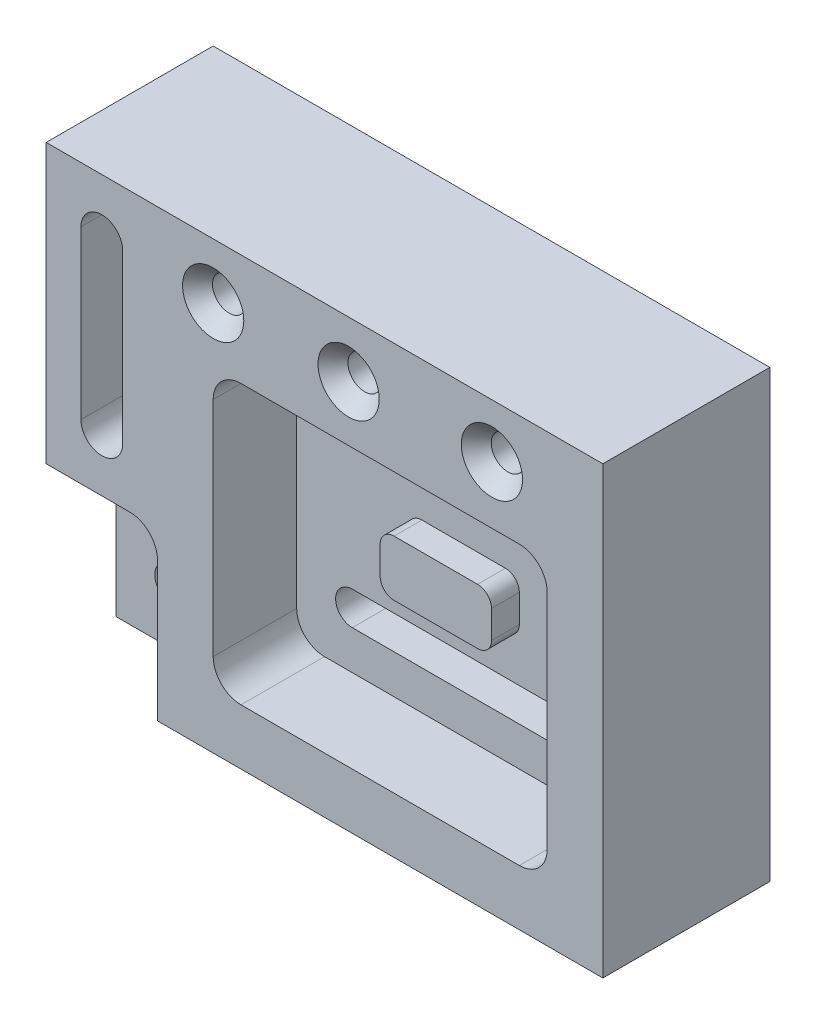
SolidWorks part; units mm, degrees
ref_plane "Plane1" through (0, 0, 0) normal (0, 0, 1) x (1, 0, 0)
ref_plane "Plane2" through (0, 0, 0) normal (0, 1, 0) x (1, 0, 0)
ref_plane "Plane3" through (0, 0, 0) normal (1, 0, 0) x (0, 0, -1)
sketch "Sketch1" plane through (0, 0, 0) normal (0, 0, 1) x (1, 0, 0)
  line L0 (-100, 80) -> (100, 80)
  line L1 (-100, 80) -> (-100, -80)
  line L2 (100, -80) -> (-100, -80)
  line L3 (100, -80) -> (100, 80)
extrude "Base-Extrude" add sketch "Sketch1" against normal blind 60
sketch "Sketch2" plane through (0, 0, 0) normal (0, 0, 1) x (1, 0, 0)
  line L0 (-30, 40) -> (70, 40)
  line L1 (-40, 30) -> (-40, -50)
  line L2 (70, -60) -> (-30, -60)
  line L3 (80, -50) -> (80, 30)
  arc A0 (80, 30) -> (70, 40) centre (70, 30) ccw
  arc A1 (80, -50) -> (70, -60) centre (70, -50) cw
  arc A2 (-30, -60) -> (-40, -50) centre (-30, -50) cw
  arc A3 (-40, 30) -> (-30, 40) centre (-30, 30) cw
  dimension "D1" = 10
extrude "Cut-Extrude1" cut sketch "Sketch2" against normal blind 30
sketch "Sketch3" plane through (0, 0, 0) normal (0, 0, 1) x (1, 0, 0)
  line L0 (-120, -20) -> (-70, -20)
  line L1 (-120, -20) -> (-120, -100)
  line L2 (-60, -100) -> (-120, -100)
  line L3 (-60, -100) -> (-60, -30)
  arc A0 (-60, -30) -> (-70, -20) centre (-70, -30) ccw
  dimension "D1" = 10
extrude "Cut-Extrude2" cut sketch "Sketch3" against normal blind 25
hole_wizard "Hole1" positions "Sketch8" profile "Sketch7" legacy
sketch "Sketch8" plane through (0, 0, 0) normal (0, 0, 1) x (1, 0, 0)
  point P0 (-40, 60)
sketch "Sketch7" plane through (-40, 60, 0) normal (1, 0, 0) x (0, -1, 0)
  line L0 (0, 0) -> (0, 60)
  line L1 (0, 60) -> (6, 60)
  line L2 (6, 60) -> (6, 5.7518)
  line L3 (6, 5.7518) -> (11, 0)
  line L4 (11, 0) -> (0, 0)
  line L5 (0, -6.4453) -> (0, 115.525) construction
  line L6 (-6, 5.7518) -> (-11, 0) construction
  dimension "Diameter" = 12
  dimension "Depth" = 60
  dimension "C-Sink Angle" = 82
  dimension "C-Sink Diameter" = 22
hole_wizard "Hole4" positions "Sketch17" profile "Sketch18" legacy
sketch "Sketch17" plane through (41.9973, -0.1277, 0) normal (0, 0, 1) x (1, 0, 0)
  point P0 (-33.3333, 60)
sketch "Sketch18" plane through (8.6639, 59.8723, 0) normal (1, 0, 0) x (0, -1, 0)
  line L0 (0, 0) -> (0, 60)
  line L1 (0, 60) -> (6, 60)
  line L2 (6, 60) -> (6, 5.7518)
  line L3 (6, 5.7518) -> (11, 0)
  line L4 (11, 0) -> (0, 0)
  line L5 (0, -6.4453) -> (0, 115.525) construction
  line L6 (-6, 5.7518) -> (-11, 0) construction
  dimension "Diameter" = 12
  dimension "Depth" = 60
  dimension "C-Sink Angle" = 82
  dimension "C-Sink Diameter" = 22
hole_wizard "Hole5" positions "Sketch19" profile "Sketch20" legacy
sketch "Sketch19" plane through (100.1484, 0.6571, 0) normal (0, 0, 1) x (1, 0, 0)
  point P0 (-40, 60)
sketch "Sketch20" plane through (60.1484, 60.6571, 0) normal (1, 0, 0) x (0, -1, 0)
  line L0 (0, 0) -> (0, 60)
  line L1 (0, 60) -> (6, 60)
  line L2 (6, 60) -> (6, 5.7518)
  line L3 (6, 5.7518) -> (11, 0)
  line L4 (11, 0) -> (0, 0)
  line L5 (0, -6.4453) -> (0, 115.525) construction
  line L6 (-6, 5.7518) -> (-11, 0) construction
  dimension "Diameter" = 12
  dimension "Depth" = 60
  dimension "C-Sink Angle" = 82
  dimension "C-Sink Diameter" = 22
sketch "Sketch21" plane through (0, 0, -25) normal (0, 0, 1) x (1, 0, 0)
  circle A0 centre (-80, -33.3333) radius 6
  circle A1 centre (-80, -60) radius 6
  dimension "D1" = 12
  dimension "D2" = 12
extrude "Cut-Extrude4" cut sketch "Sketch21" against normal through all
sketch "Sketch22" plane through (0, 0, 0) normal (0, 0, 1) x (1, 0, 0)
  line L0 (-72.5, 60) -> (-72.5, 0)
  line L1 (-87.5, 60) -> (-87.5, 0)
  arc A0 (-87.5, 0) -> (-72.5, 0) centre (-80, 0) ccw
  arc A1 (-72.5, 60) -> (-87.5, 60) centre (-80, 60) ccw
  dimension "D1" = 15
  dimension "D2" = 15
extrude "Cut-Extrude5" cut sketch "Sketch22" against normal blind 25
sketch "Sketch23" plane through (0, 0, -30) normal (0, 0, 1) x (1, 0, 0)
  line L0 (-20, 26) -> (60.1484, 26)
  line L1 (-20, 14) -> (60.1484, 14)
  line L2 (-20, -34) -> (60.1484, -34)
  line L3 (-20, -46) -> (60.1484, -46)
  arc A0 (-20, 26) -> (-20, 14) centre (-20, 20) ccw
  arc A1 (60.1484, 14) -> (60.1484, 26) centre (60.1484, 20) ccw
  arc A2 (-20, -34) -> (-20, -46) centre (-20, -40) ccw
  arc A3 (60.1484, -46) -> (60.1484, -34) centre (60.1484, -40) ccw
  dimension "D1" = 12
  dimension "D2" = 12
  dimension "D3" = 12
  dimension "D4" = 12
extrude "Cut-Extrude6" cut sketch "Sketch23" against normal through all
sketch "Sketch24" plane through (0, 0, -30) normal (0, 0, 1) x (1, 0, 0)
  line L0 (5, 0) -> (35, 0)
  line L1 (0, -5) -> (0, -15)
  line L2 (35, -20) -> (5, -20)
  line L3 (40, -15) -> (40, -5)
  arc A0 (40, -5) -> (35, 0) centre (35, -5) ccw
  arc A1 (40, -15) -> (35, -20) centre (35, -15) cw
  arc A2 (5, -20) -> (0, -15) centre (5, -15) cw
  arc A3 (0, -5) -> (5, 0) centre (5, -5) cw
  point P13 (0, 0)
  dimension "D1" = 5
extrude "Boss-Extrude1" add sketch "Sketch24" along normal blind 10
sketch "Clamps" plane through (0, 0, 0) normal (0, 0, 1) x (1, 0, 0)
  line L1 (7.6257, -119.7234) -> (34.5698, -119.7234)
  line L2 (7.6257, -119.7234) -> (7.6257, -38.3827)
  line L3 (7.6257, -38.3827) -> (34.5698, -38.3827)
  line L4 (34.5698, -119.7234) -> (34.5698, -38.3827)
  line L5 (-195.9011, 36.3491) -> (-58.972, 36.3491)
  line L6 (-195.9011, 36.3491) -> (-195.9011, 8.3883)
  line L7 (-195.9011, 8.3883) -> (-58.972, 8.3883)
  line L8 (-58.972, 36.3491) -> (-58.972, 8.3883)
